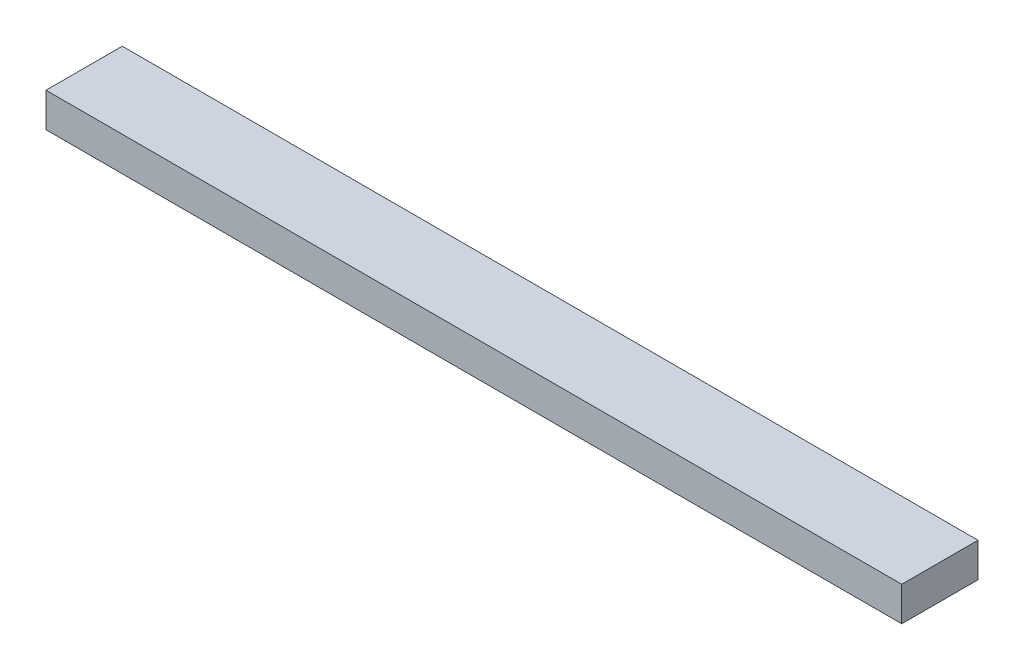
SolidWorks part; units mm, degrees
ref_plane "Front Plane" through (0, 0, 0) normal (0, 0, 1) x (1, 0, 0)
ref_plane "Top Plane" through (0, 0, 0) normal (0, 1, 0) x (1, 0, 0)
ref_plane "Right Plane" through (0, 0, 0) normal (1, 0, 0) x (0, 0, -1)
sketch "Sketch1" plane through (0, 0, 0) normal (1, 0, 0) x (0, 0, -1)
  line L1 (-25.1992, 5.9797) -> (14.9008, 5.9797)
  line L2 (-25.1992, 5.9797) -> (-25.1992, -12.0203)
  line L3 (-25.1992, -12.0203) -> (14.9008, -12.0203)
  line L4 (14.9008, 5.9797) -> (14.9008, -12.0203)
  dimension "D1" = 40.1
  dimension "D2" = 18
extrude "Boss-Extrude1" add sketch "Sketch1" along normal blind 450
